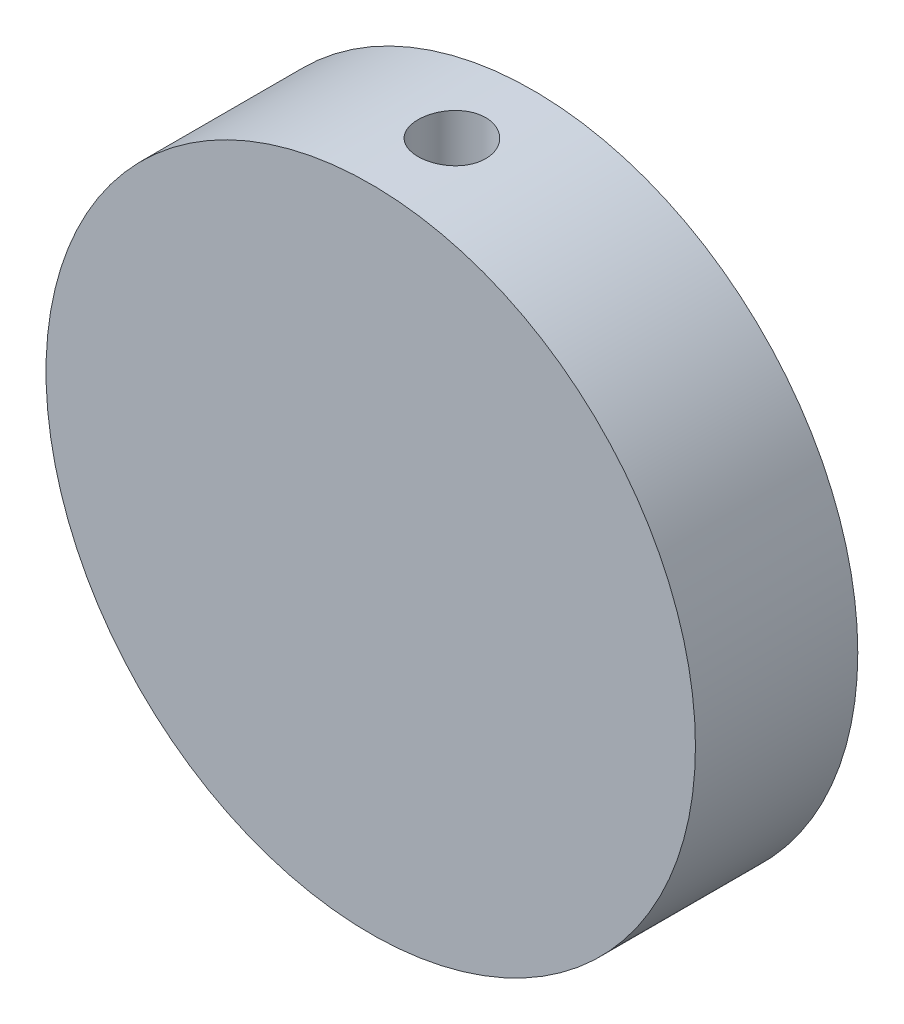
SolidWorks part; units mm, degrees
ref_plane "Face" through (0, 0, 0) normal (0, 0, 1) x (1, 0, 0)
ref_plane "Dessus" through (0, 0, 0) normal (0, 1, 0) x (1, 0, 0)
ref_plane "Droite" through (0, 0, 0) normal (1, 0, 0) x (0, 0, -1)
sketch "Esquisse1" plane through (0, 0, 0) normal (0, 0, 1) x (1, 0, 0)
  circle A0 centre (0, 0) radius 12
  dimension "D1" = 24
extrude "Base-Extrusion" add sketch "Esquisse1" along normal blind 6
sketch "Esquisse2" plane through (0, 0, 0) normal (0, 1, 0) x (1, 0, 0)
  line L0 (0, -6) -> (0, 0) construction
  circle A0 centre (0, -3) radius 1.25
extrude "Enlèv. mat.-Extru.1" cut sketch "Esquisse2" against normal mid plane 28
